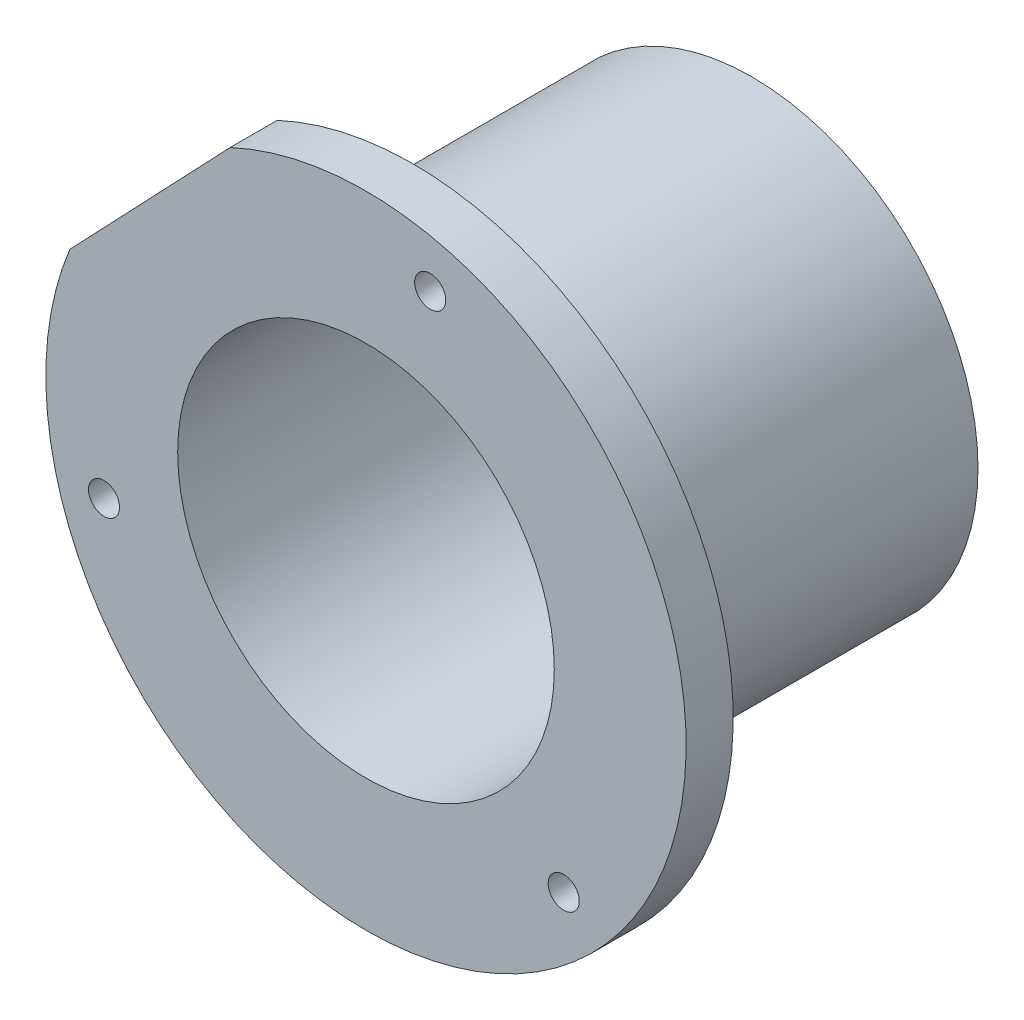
SolidWorks part; units mm, degrees
ref_plane "前视基准面" through (0, 0, 0) normal (0, 0, 1) x (1, 0, 0)
ref_plane "上视基准面" through (0, 0, 0) normal (0, 1, 0) x (1, 0, 0)
ref_plane "右视基准面" through (0, 0, 0) normal (1, 0, 0) x (0, 0, -1)
sketch "草图2" plane through (0, 0, 0) normal (0, 0, 1) x (1, 0, 0)
  circle A0 centre (17, 52) radius 24
  circle A2 centre (17, 52) radius 20
  dimension "D1" = 48
  dimension "D2" = 40
extrude "拉伸1" add sketch "草图2" against normal blind 34 and the other way blind 2
sketch "草图3" plane through (0, 0, -34) normal (0, 0, -1) x (-1, 0, 0)
  circle A0 centre (-17, 52) radius 20
  circle A1 centre (-17, 52) radius 15
  dimension "D1" = 40
  dimension "D2" = 30
extrude "拉伸2" add sketch "草图3" against normal blind 4
sketch "草图4" plane through (0, 0, 2) normal (0, 0, 1) x (1, 0, 0)
  line L0 (2.5699, 82.7859) -> (-14.4528, 64.9121)
  line L1 (-0.1979, 81.3297) -> (-13.1333, 67.7476) construction
  arc A0 (-14.4528, 64.9121) -> (2.5699, 82.7859) centre (17, 52) ccw
  circle A1 centre (17, 52) radius 20
  circle A2 centre (17, 52) radius 34 construction
  circle A3 centre (-25, 92) radius 27 construction
  dimension "D1" = 68
  dimension "D2" = 40
  dimension "D3" = 2
extrude "拉伸3" add sketch "草图4" along normal blind 5
hole_wizard "M4 螺纹孔1" positions "草图7" profile "草图6" tap size "M4" standard "ISO"
sketch "草图7" plane through (0, 0, 7) normal (0, 0, 1) x (1, 0, 0)
  point P1 (23.8205, 80.1865)
  point P4 (-10.8205, 43.8135)
  point P7 (38, 32)
sketch "草图6" plane through (23.8205, 80.1865, 7) normal (1, 0, 0) x (0, -1, 0)
  line L0 (0, 0) -> (0, 41)
  line L1 (0, 41) -> (1.65, 41)
  line L2 (1.65, 41) -> (1.65, 0)
  line L5 (1.65, 0) -> (0, 0)
  line L11 (0, -6.35) -> (0, 107.95) construction
  dimension "籵謂蹟恇謂郰芛眻噤" = 3.3
  dimension "籵謂蹟恇謂郰芛旮僅" = 41
